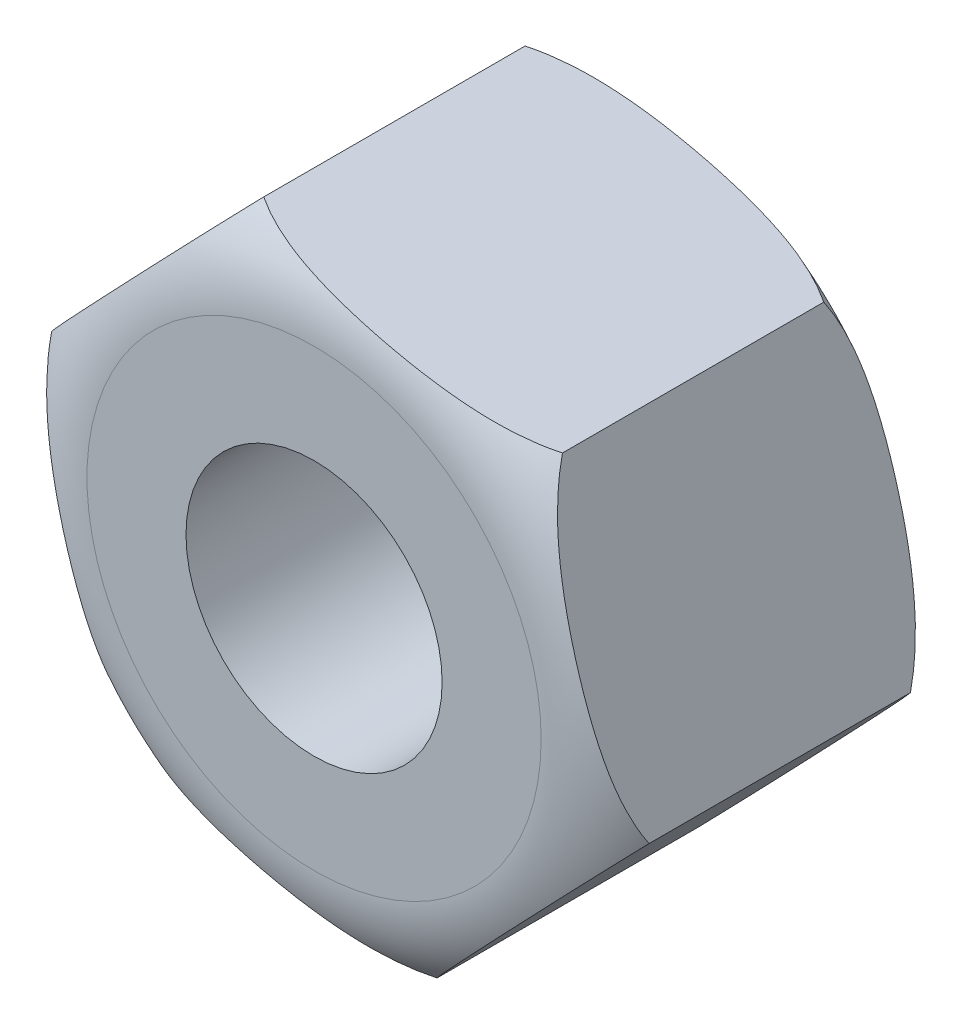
SolidWorks part; units mm, degrees
ref_plane "Front Plane" through (0, 0, 0) normal (0, 0, 1) x (1, 0, 0)
ref_plane "Top Plane" through (0, 0, 0) normal (0, 1, 0) x (1, 0, 0)
ref_plane "Right Plane" through (0, 0, 0) normal (1, 0, 0) x (0, 0, -1)
sketch "Sketch1" plane through (0, 0, 0) normal (0, 0, 1) x (1, 0, 0)
  circle A0 centre (0, 0) radius 25
  dimension "D1" = 50
extrude "Boss-Extrude1" add sketch "Sketch1" along normal blind 25
fillet "Fillet1" radius 8 2 edges at (25, 0, 25) (25, 0, 0)
sketch "Sketch2" plane through (0, 0, 0) normal (0, 0, -1) x (-1, 0, 0)
  line L1 (22.3612, 5.4217) -> (6.4852, 22.0762)
  line L2 (6.4852, 22.0762) -> (-15.876, 16.6545)
  line L3 (-15.876, 16.6545) -> (-22.3612, -5.4217)
  line L4 (-22.3612, -5.4217) -> (-6.4852, -22.0762)
  line L5 (-6.4852, -22.0762) -> (15.876, -16.6545)
  line L6 (15.876, -16.6545) -> (22.3612, 5.4217)
  circle A1 centre (0, 0) radius 9.5861
  circle A2 centre (0, 0) radius 19.9265 construction
extrude "Cut-Extrude2" cut sketch "Sketch2" against normal blind 25 and the other way blind 10 flip side to cut
